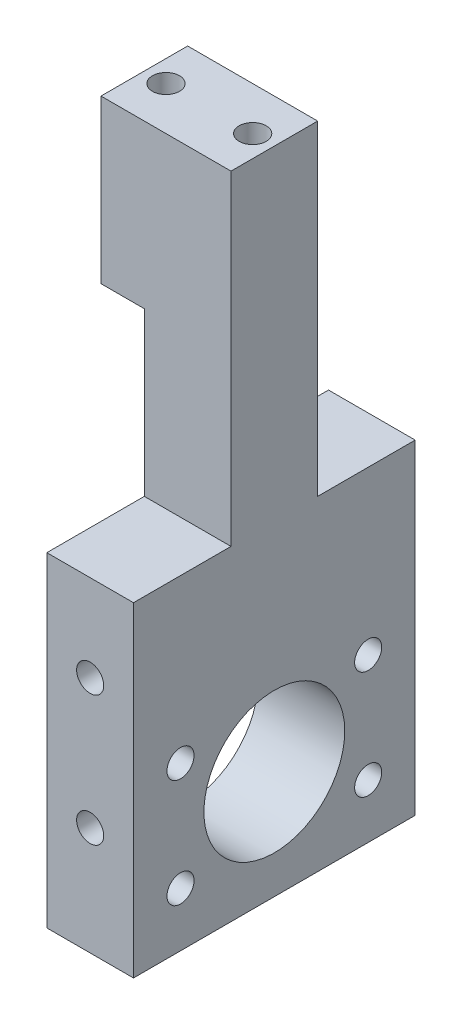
SolidWorks part; units mm, degrees
ref_plane "Front Plane" through (0, 0, 0) normal (0, 0, 1) x (1, 0, 0)
ref_plane "Top Plane" through (0, 0, 0) normal (0, 1, 0) x (1, 0, 0)
ref_plane "Right Plane" through (0, 0, 0) normal (1, 0, 0) x (0, 0, -1)
sketch "Sketch1" plane through (0, 0, 0) normal (1, 0, 0) x (0, 0, -1)
  line L0 (-13, -10) -> (13, -10)
  line L1 (-13, 20) -> (-4, 20)
  line L2 (-4, 20) -> (-4, 50)
  line L3 (-4, 50) -> (4, 50)
  line L4 (4, 50) -> (4, 20)
  line L5 (4, 20) -> (13, 20)
  line L6 (13, 20) -> (13, -10)
  line L7 (-13, 20) -> (-13, -10)
  circle A0 centre (0, 0) radius 6.5
  dimension "D1" = 13
  dimension "D2" = 26
  dimension "D3" = 13
  dimension "D4" = 10
  dimension "D5" = 30
  dimension "D6" = 60
  dimension "D7" = 8
extrude "Boss-Extrude1" add sketch "Sketch1" along normal blind 12
hole_wizard "M3x0.5 Tapped Hole1" positions "Sketch7" profile "Sketch6" tap size "M3x0.5" standard "ANSI Metric"
sketch "Sketch7" plane through (0, 50, 0) normal (0, 1, 0) x (1, 0, 0)
  line L0 (0, 0) -> (2, 0) construction
  line L1 (2, 0) -> (10, 0) construction
  line L3 (12, 4) -> (12, -4) construction
  line L4 (0, 4) -> (0, -4) construction
  point P0 (2, 0)
  point P2 (10, 0)
  dimension "D1" = 2
  dimension "D2" = 2
sketch "Sketch6" plane through (2, 50, 0) normal (1, 0, 0) x (0, 0, 1)
  line L0 (0, 0) -> (0, 9.2511)
  line L1 (0, 9.2511) -> (1.25, 8.5)
  line L2 (1.25, 8.5) -> (1.25, 0)
  line L5 (1.25, 0) -> (0, 0)
  line L10 (0, 9.2511) -> (-1.25, 8.5) construction
  line L11 (0, -6.35) -> (0, 107.95) construction
  dimension "Tap Drill Dia." = 2.5
  dimension "Tap Drill Depth" = 8.5
  dimension "Drill Angle" = 118
sketch "Sketch8" plane through (0, 0, -13) normal (0, 0, -1) x (-1, 0, 0)
  line L5 (0, -10) -> (-4, -10)
  line L6 (0, -10) -> (0, 35)
  line L7 (0, 35) -> (-4, 35)
  line L8 (-4, -10) -> (-4, 35)
  dimension "D1" = 45
  dimension "D2" = 4
extrude "Cut-Extrude2" cut sketch "Sketch8" against normal through all
hole_wizard "M3x0.5 Tapped Hole2" positions "Sketch10" profile "Sketch9" tap size "M3x0.5" standard "ANSI Metric"
sketch "Sketch10" plane through (12, 0, 0) normal (1, 0, 0) x (0, 0, -1)
  point P0 (-8.6603, 5)
  point P3 (-8.6603, -5)
  point P6 (8.6603, -5)
  point P9 (8.6603, 5)
sketch "Sketch9" plane through (12, 5, 8.6603) normal (0, 1, 0) x (0, 0, -1)
  line L0 (0, 0) -> (0, 12)
  line L1 (0, 12) -> (1.25, 12)
  line L2 (1.25, 12) -> (1.25, 0)
  line L5 (1.25, 0) -> (0, 0)
  line L11 (0, -6.35) -> (0, 107.95) construction
  dimension "Thru Tap Drill Dia." = 2.5
  dimension "Thru Tap Drill Depth" = 12
hole_wizard "M3x0.5 Tapped Hole3" positions "Sketch12" profile "Sketch11" tap size "M3x0.5" standard "ANSI Metric"
sketch "Sketch12" plane through (0, 0, 13) normal (0, 0, 1) x (1, 0, 0)
  point P0 (8, 0)
  point P3 (8, 12)
sketch "Sketch11" plane through (8, 0, 13) normal (1, 0, 0) x (0, -1, 0)
  line L0 (0, 0) -> (0, 8.2511)
  line L1 (0, 8.2511) -> (1.25, 7.5)
  line L2 (1.25, 7.5) -> (1.25, 0)
  line L5 (1.25, 0) -> (0, 0)
  line L10 (0, 8.2511) -> (-1.25, 7.5) construction
  line L11 (0, -6.35) -> (0, 107.95) construction
  dimension "Tap Drill Dia." = 2.5
  dimension "Tap Drill Depth" = 7.5
  dimension "Drill Angle" = 118
